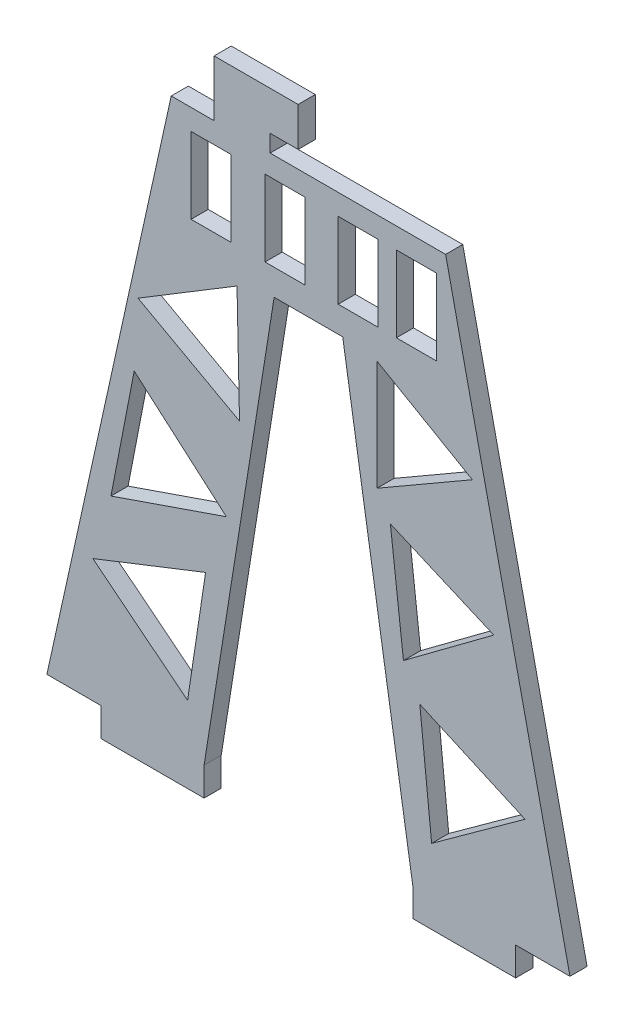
SolidWorks part; units mm, degrees
ref_plane "Alzado" through (0, 0, 0) normal (0, 0, 1) x (1, 0, 0)
ref_plane "Planta" through (0, 0, 0) normal (0, 1, 0) x (1, 0, 0)
ref_plane "Vista lateral" through (0, 0, 0) normal (1, 0, 0) x (0, 0, -1)
sketch "Sketch1" plane through (0, 0, 0) normal (0, 0, 1) x (1, 0, 0)
  line L0 (-45.75, 0) -> (-18.25, 0)
  line L2 (-24, 98.5) -> (24, 98.5)
  line L3 (-24, 98.5) -> (-45.75, 0)
  line L4 (24, 98.5) -> (45.75, 0)
  line L5 (-6, 77) -> (6, 77)
  line L6 (-6, 77) -> (-18.25, 0)
  line L7 (-36.25, 0) -> (-18.25, 0)
  line L8 (-36.25, 0) -> (-36.25, -5)
  line L9 (-36.25, -5) -> (-18.25, -5)
  line L10 (-18.25, 0) -> (-18.25, -5)
  line L11 (18.25, 0) -> (36.25, 0)
  line L12 (18.25, 0) -> (18.25, -5)
  line L13 (18.25, -5) -> (36.25, -5)
  line L14 (36.25, 0) -> (36.25, -5)
  line L15 (6, 77) -> (18.25, 0)
  line L16 (18.25, 0) -> (45.75, 0)
  line L17 (-16.5, 108.3179) -> (-1.8, 108.3179)
  line L18 (-16.5, 98.5) -> (-6.7, 98.5)
  line L19 (-16.5, 98.5) -> (-16.5, 108.3179)
  line L20 (-16.5, 108.3179) -> (-6.7, 108.3179)
  line L21 (-6.7, 98.5) -> (-6.7, 101.5)
  line L22 (-1.8, 108.3179) -> (-1.8, 101.5)
  line L23 (-1.8, 101.5) -> (-6.7, 101.5)
  line L24 (-7.5943, 94.8662) -> (-0.5943, 94.8662)
  line L25 (-20.5245, 94.8662) -> (-13.5245, 94.8662)
  line L26 (-20.5245, 94.8662) -> (-20.5245, 81.5519)
  line L27 (-20.5245, 81.5519) -> (-13.5245, 81.5519)
  line L28 (-13.5245, 94.8662) -> (-13.5245, 81.5519)
  line L29 (-7.5943, 94.8662) -> (-7.5943, 81.5519)
  line L30 (-7.5943, 81.5519) -> (-0.5943, 81.5519)
  line L31 (-0.5943, 94.8662) -> (-0.5943, 81.5519)
  line L32 (5.2079, 94.8662) -> (12.2079, 94.8662)
  line L33 (5.2079, 94.8662) -> (5.2079, 81.5519)
  line L34 (5.2079, 81.5519) -> (12.2079, 81.5519)
  line L35 (12.2079, 94.8662) -> (12.2079, 81.5519)
  line L36 (15.3857, 94.8662) -> (22.3857, 94.8662)
  line L37 (15.3857, 94.8662) -> (15.3857, 81.5519)
  line L38 (15.3857, 81.5519) -> (22.3857, 81.5519)
  line L39 (22.3857, 94.8662) -> (22.3857, 81.5519)
  line L44 (-37.7155, 21.5615) -> (-21.1361, 8.359)
  line L45 (-21.1361, 8.359) -> (-17.9922, 29.3184)
  line L46 (-17.9922, 29.3184) -> (-37.7155, 21.5615)
  line L47 (-14.3506, 39.5803) -> (-30.4761, 53.5887)
  line L48 (-30.4761, 53.5887) -> (-34.545, 32.6194)
  line L49 (-34.545, 32.6194) -> (-14.3506, 39.5803)
  line L50 (-12.0562, 55.2134) -> (-12.4914, 75.4626)
  line L51 (-12.4914, 75.4626) -> (-29.81, 64.9611)
  line L52 (-29.81, 64.9611) -> (-12.0562, 55.2134)
  line L53 (11.993, 76.3285) -> (28.6731, 66.6983)
  line L54 (28.6731, 66.6983) -> (11.993, 57.068)
  line L55 (11.993, 57.068) -> (11.993, 76.3285)
  line L56 (14.3386, 52.8442) -> (16.6226, 33.2788)
  line L57 (16.6226, 33.2788) -> (32.4247, 45.0395)
  line L58 (32.4247, 45.0395) -> (14.3386, 52.8442)
  line L59 (19.4817, 28.0994) -> (21.5515, 8.0454)
  line L60 (21.5515, 8.0454) -> (37.8839, 19.8649)
  line L61 (37.8839, 19.8649) -> (19.4817, 28.0994)
  circle A0 centre (-25.6146, 19.7463) radius 6.1181 construction
  circle A1 centre (-26.4572, 41.9294) radius 6.1662 construction
  circle A2 centre (-18.1192, 65.2123) radius 5.8468 construction
  circle A3 centre (17.553, 66.6983) radius 5.56 construction
  circle A4 centre (21.1286, 43.7208) radius 5.6864 construction
  circle A5 centre (26.3057, 18.6699) radius 5.8198 construction
  point P4 (0, 0)
  point P10 (0, 98.5)
  point P13 (0, 77)
  point P57 (37.8839, 19.8649)
  point P62 (-36.25, 21.3416)
  point P64 (-14.3506, 39.5803)
  point P74 (-12.4914, 55.2134)
  dimension "D1" = 91.5
  dimension "D2" = 7
  dimension "D3" = 48
  dimension "D4" = 12
  dimension "D5" = 9.5
  dimension "D6" = 18
  dimension "D7" = 5
  dimension "D8" = 0
  dimension "D9" = 9.5
  dimension "D10" = 18
  dimension "D11" = 5
  dimension "D12" = 9.8
  dimension "D13" = 9.8179
  dimension "D14" = 7.5
  dimension "D15" = 14.7
  dimension "D16" = 3
  dimension "D17" = 7
  dimension "D18" = 7
  dimension "D19" = 7
  dimension "D20" = 3.1778
extrude "Boss-Extrude1" add sketch "Sketch1" along normal blind 3 contours L11 L16 L4 L2 L3 L0 L6 L5 L15 L61 L60 L59 L58 L57 L56 L52 L51 L50 L49 L48 L47 L46 L45 L44 L25 L28 L27 L26 L24 L31 L30 L29 L32 L35 L34 L33 L36 L39 L38 | L23 L22 L17 L19 L2 L21 | L14 L11 L12 L13 | L10 L0 L8 L9
